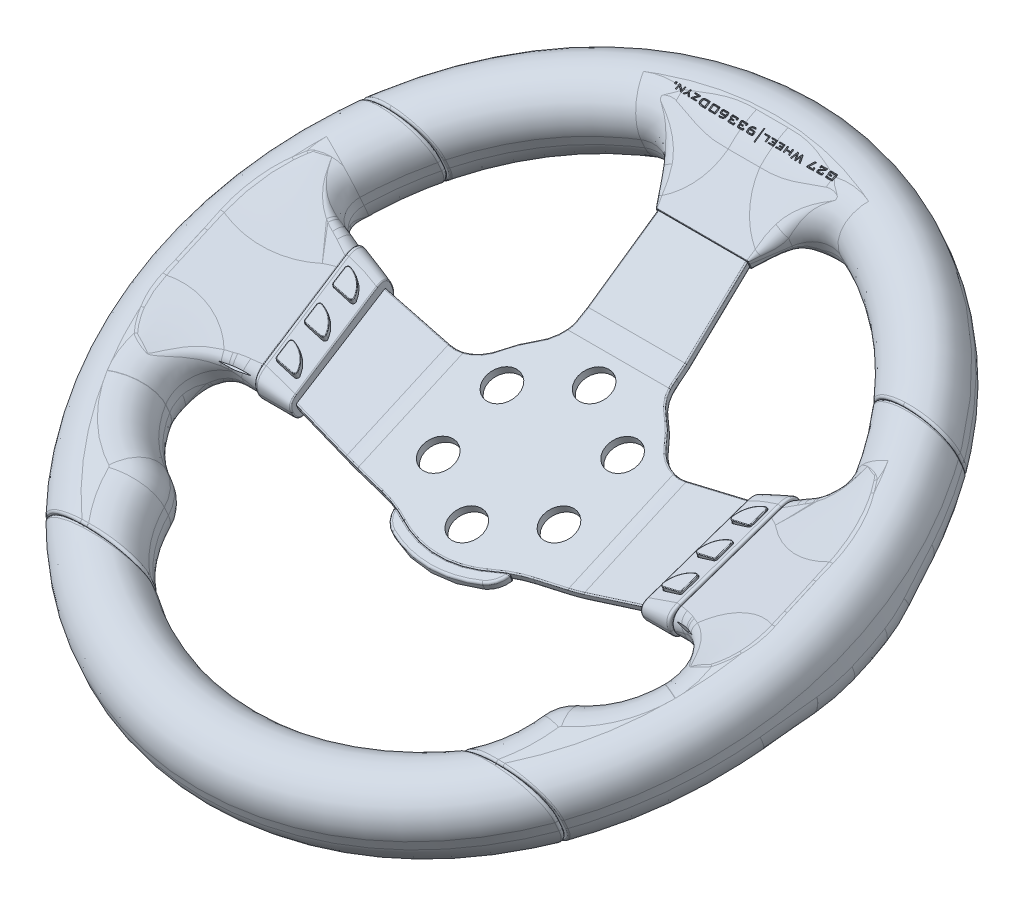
SolidWorks part; units mm, degrees
ref_plane "Plan de face" through (0, 0, 0) normal (0, 0, 1) x (1, 0, 0)
ref_plane "Plan de dessus" through (0, 0, 0) normal (0, 1, 0) x (1, 0, 0)
ref_plane "Plan de droite" through (0, 0, 0) normal (1, 0, 0) x (0, 0, -1)
imported_body "Importée1"
imported_body "Importée2"
imported_body "Importée3"
imported_body "Importée4"
imported_body "Importée5"
imported_body "Importée6"
imported_body "Importée9"
sketch "Esquisse1" plane through (0, 93.3688, 41.5705) normal (0, -0.9135, -0.4067) x (1, 0, 0)
  line L0 (-4.6276, 20.5681) -> (-20.3337, 20.5681) construction
  line L1 (20.3337, 20.5681) -> (4.6276, 20.5681) construction
  line L2 (-4.6276, 20.5681) -> (-20.3337, 20.5681)
  line L3 (20.3337, 20.5681) -> (4.6276, 20.5681)
  line L4 (-20.3337, 20.5681) -> (-52.2614, 45.9207)
  line L5 (-52.2614, 45.9207) -> (-52.2614, 53.789)
  line L6 (20.3337, 20.5681) -> (49.4464, 44.789)
  line L7 (52.2614, 63.789) -> (52.2614, 53.789)
  line L8 (25.9966, 95.5201) -> (49.5977, 76.0028)
  line L9 (-22.643, 97.6772) -> (-50.5638, 72.9154)
  line L10 (-52.2614, 63.789) -> (-52.2614, 53.789)
  arc A0 (18.125, 99.9774) -> (-17.9803, 100.0408) centre (0, 58.789) ccw construction
  arc A1 (25.9966, 95.5201) -> (-22.643, 97.6772) centre (0, 58.789) ccw
  arc A2 (50.8985, 45.9207) -> (52.2614, 53.789) centre (0, 58.789) ccw construction
  arc A3 (50.8985, 45.9207) -> (52.2614, 53.789) centre (0, 58.789) ccw
  arc A4 (52.2614, 63.789) -> (50.8985, 71.6573) centre (0, 58.789) ccw construction
  arc A5 (52.2614, 63.789) -> (49.5977, 76.0028) centre (0, 58.789) ccw
  arc A6 (-50.8985, 71.6573) -> (-52.2614, 63.789) centre (0, 58.789) ccw construction
  arc A7 (-50.5638, 72.9154) -> (-52.2614, 63.789) centre (0, 58.789) ccw
  spline S0 degree 3 poles (319.538, 1990.0536) (213.0253, 460.8347) (-0.0002, -420.2577) (-213.0257, 460.8365) (-319.5386, 1990.0629) knots -34.024973 -34.024973 -34.024973 -34.024973 0.5 35.025043 35.025043 35.025043 35.025043 only from (4.6276, 20.5681) to (-4.6276, 20.5681) construction
  spline S1 degree 3 poles (4.6276, 20.5681) (3.0851, 20.3813) (0, 20.1966) (-3.0851, 20.3813) (-4.6276, 20.5681) knots 0 0 0 0 0.5 1 1 1 1
  spline S2 degree 3 poles (-1746.5497, 922.2979) (-505.7748, 346.3624) (64.597, 66.778) (50.6097, 45.3294) (50.4983, 45.2081) (41.6848, 38.3318) (-35.6216, 132.8904) (1780.5986, 1042.0659) knots -37.938466 -37.938466 -37.938466 -37.938466 0.25 0.25 0.5 0.5 17.049565 17.049565 17.049565 17.049565 only from (50.8985, 45.9207) to (49.4464, 44.789) construction
  spline S3 degree 3 poles (50.8985, 45.9207) (50.8576, 45.759) (50.7917, 45.6084) (50.6097, 45.3294) (50.4983, 45.2081) (50.1048, 44.9011) (49.7798, 44.789) (49.4464, 44.789) knots 0 0 0 0 0.25 0.25 0.5 0.5 1 1 1 1
extrude "Extrusion1" cut sketch "Esquisse1" along normal blind 70
sketch "Esquisse2" plane through (0, 0, 0) normal (1, 0, 0) x (0, 0, -1)
  line L0 (-150.6975, 0) -> (-159.1345, 16.2248)
  line L1 (-159.1345, 16.2248) -> (-39.2531, 70.6779)
  line L2 (-39.2531, 70.6779) -> (-32.0668, 54.8567)
  line L3 (-32.0668, 54.8567) -> (-150.6975, 0)
extrude "Extrusion2" cut sketch "Esquisse2" against normal through all and the other way through all
sketch "Esquisse3" plane through (0, 96.1094, 42.7907) normal (0, 0.9135, 0.4067) x (1, 0, 0)
  line L5 (-42.2232, -42.3364) -> (-42.2232, -88.0317)
  line L6 (-42.2232, -88.0317) -> (-30.3803, -90.4412)
  line L7 (30.3803, -90.4412) -> (42.2232, -88.0317)
  line L8 (42.2232, -88.0317) -> (42.2232, -42.3364)
  line L9 (20.2102, -20.1699) -> (-20.2102, -20.1698)
  line L10 (-42.2232, -42.3364) -> (-42.2232, -88.0317)
  line L11 (-42.2232, -88.0317) -> (-30.3803, -90.4412)
  line L12 (30.3803, -90.4412) -> (42.2232, -88.0317)
  line L13 (42.2232, -88.0317) -> (42.2232, -42.3364)
  line L14 (20.2102, -20.1699) -> (-20.2102, -20.1698)
  arc A1 (20.2102, -20.1699) -> (25.2791, -27.7895) centre (35.0747, -15.7772) ccw
  arc A2 (20.2102, -20.1699) -> (25.2791, -27.7895) centre (35.0747, -15.7772) ccw
  spline S8 degree 2 poles (2349.6089, -1843.8638) (136.6279, 148.0238) (-29.3795, -31.644) (-195.3029, -211.221) (1958.9841, -2265.5925) knots -42.86377 -42.86377 -42.86377 0.5 0.5 43.850219 43.850219 43.850219 only from (-25.2791, -27.7895) to (-32.8983, -36.0359)
  spline S9 degree 2 poles (-2120.1303, 2113.1345) (73.887, 69.5745) (-34.7282, -38.2211) (-35.7616, -39.2466) (-36.9687, -40.0623) (-38.1751, -40.8775) (-39.5131, -41.454) (-179.9404, -101.9651) (-1268.1978, 2691.2035) knots -26.486354 -26.486354 -26.486354 0.25 0.25 0.5 0.5 0.75 0.75 27.475703 27.475703 27.475703 only from (-32.8983, -36.0359) to (-42.2232, -42.3364)
  spline S10 degree 2 poles (-1342.3397, -2772.7242) (-295.9252, -0.5752) (-23.7336, -92.229) (248.3282, -183.8392) (-587.7732, -3025.8093) knots -41.150282 -41.150282 -41.150282 0.5 0.5 42.137021 42.137021 42.137021 only from (-30.3803, -90.4412) to (-17.3593, -94.8258)
  spline S11 degree 2 poles (507.0216, 2848.8116) (-248.6135, -42.3339) (-9.0146, -97.76) (-6.8052, -98.2711) (-4.5512, -98.5292) (-2.2835, -98.789) (0, -98.789) (2.2825, -98.789) (4.5512, -98.5292) (6.8042, -98.2712) (9.0146, -97.76) (248.5539, -42.3542) (-503.9942, 2849.3538) knots -13.566852 -13.566852 -13.566852 0.25 0.25 0.375 0.375 0.5 0.5 0.625 0.625 0.75 0.75 14.564908 14.564908 14.564908 only from (-17.3593, -94.8258) to (17.3593, -94.8258)
  spline S12 degree 2 poles (595.0999, -3024.3472) (-248.4561, -183.8883) (23.7336, -92.229) (295.7936, -0.6135) (1349.0584, -2769.4567) knots -41.150282 -41.150282 -41.150282 0.5 0.5 42.137021 42.137021 42.137021 only from (17.3593, -94.8258) to (30.3803, -90.4412)
  spline S13 degree 2 poles (1257.3426, 2696.0867) (180.0517, -102.0017) (39.5131, -41.454) (38.176, -40.878) (36.9687, -40.0623) (35.7624, -39.2473) (34.7282, -38.2211) (-73.8115, 69.4849) (2111.5505, 2121.3847) knots -26.486363 -26.486363 -26.486363 0.25 0.25 0.5 0.5 0.75 0.75 27.475712 27.475712 27.475712 only from (42.2232, -42.3364) to (32.8983, -36.0359)
  spline S14 degree 2 poles (-1964.9833, -2260.1509) (195.3819, -211.3164) (29.3795, -31.644) (-136.5391, 147.9375) (-2354.5599, -1837.4537) knots -42.86377 -42.86377 -42.86377 0.5 0.5 43.850219 43.850219 43.850219 only from (32.8983, -36.0359) to (25.2791, -27.7895)
  spline S15 degree 2 poles (-2696.6735, 1325.8536) (43.5314, 116.1311) (-21.0269, -22.3277) (-21.5211, -23.3877) (-22.1694, -24.3623) (-22.8172, -25.336) (-23.6044, -26.2023) (-126.2476, -139.1434) (-2313.0147, 1906.571) knots -32.771815 -32.771815 -32.771815 0.25 0.25 0.5 0.5 0.75 0.75 33.753502 33.753502 33.753502 only from (-20.2102, -20.1698) to (-25.2791, -27.7895)
  spline S16 degree 2 poles (-25.2791, -27.7895) (-27.4653, -29.5724) (-29.3795, -31.644) (-31.2932, -33.7153) (-32.8983, -36.0359) knots 0 0 0 0.5 0.5 1 1 1
  spline S17 degree 2 poles (-32.8983, -36.0359) (-33.7126, -37.2131) (-34.7282, -38.2211) (-35.7616, -39.2466) (-36.9687, -40.0623) (-38.1751, -40.8775) (-39.5131, -41.454) (-40.8267, -42.02) (-42.2232, -42.3364) knots 0 0 0 0.25 0.25 0.5 0.5 0.75 0.75 1 1 1
  spline S18 degree 2 poles (-30.3803, -90.4412) (-27.0012, -91.1287) (-23.7336, -92.229) (-20.4665, -93.3291) (-17.3593, -94.8258) knots 0 0 0 0.5 0.5 1 1 1
  spline S19 degree 2 poles (-17.3593, -94.8258) (-13.3498, -96.7571) (-9.0146, -97.76) (-6.8052, -98.2711) (-4.5512, -98.5292) (-2.2835, -98.789) (0, -98.789) (2.2825, -98.789) (4.5512, -98.5292) (6.8042, -98.2712) (9.0146, -97.76) (13.3494, -96.7573) (17.3593, -94.8258) knots 0 0 0 0.25 0.25 0.375 0.375 0.5 0.5 0.625 0.625 0.75 0.75 1 1 1
  spline S20 degree 2 poles (17.3593, -94.8258) (20.466, -93.3294) (23.7336, -92.229) (27.0006, -91.1289) (30.3803, -90.4412) knots 0 0 0 0.5 0.5 1 1 1
  spline S21 degree 2 poles (42.2232, -42.3364) (40.8272, -42.0202) (39.5131, -41.454) (38.176, -40.878) (36.9687, -40.0623) (35.7624, -39.2473) (34.7282, -38.2211) (33.7129, -37.2136) (32.8983, -36.0359) knots 0 0 0 0.25 0.25 0.5 0.5 0.75 0.75 1 1 1
  spline S22 degree 2 poles (32.8983, -36.0359) (31.2935, -33.7157) (29.3795, -31.644) (27.4658, -29.5728) (25.2791, -27.7895) knots 0 0 0 0.5 0.5 1 1 1
  spline S23 degree 2 poles (-20.2102, -20.1698) (-20.5382, -21.2795) (-21.0269, -22.3277) (-21.5211, -23.3877) (-22.1694, -24.3623) (-22.8172, -25.336) (-23.6044, -26.2023) (-24.382, -27.0578) (-25.2791, -27.7895) knots 0 0 0 0.25 0.25 0.5 0.5 0.75 0.75 1 1 1
  dimension "D1" = 0
extrude "Extrusion3" cut sketch "Esquisse3" along normal blind 70
sketch "Esquisse4" plane through (0, 96.1094, 42.7907) normal (0, 0.9135, 0.4067) x (1, 0, 0)
  circle A0 centre (0, -86.789) radius 6.5
  circle A1 centre (-24.2487, -72.789) radius 6.5
  circle A2 centre (-24.2487, -44.789) radius 6.5
  circle A3 centre (0, -30.789) radius 6.5
  circle A4 centre (24.2487, -44.789) radius 6.5
  circle A5 centre (24.2487, -72.789) radius 6.5
  point P0 (0, -30.789)
  point P1 (0, -58.789)
  dimension "D1" = 13
  dimension "D2" = 28
  dimension "D3" = 28
extrude "Extrusion4" cut sketch "Esquisse4" against normal blind 70
ref_plane "Plan2" through (72.4598, 72.5562, 92.2781) normal (-0.9859, -0.1527, -0.068) x (-0.0672, -0.0104, 0.9977)
ref_plane "Plan3" through (68.0194, 10.532, 4.6892) normal (-0.9859, -0.1527, -0.068) x (-0.0672, -0.0104, 0.9977)
sketch "Esquisse6" plane through (68.0194, 10.532, 4.6892) normal (-0.9859, -0.1527, -0.068) x (-0.0672, -0.0104, 0.9977)
  line L0 (95.9722, 59.6864) -> (86.6503, 63.7771)
  line L1 (86.6503, 63.7771) -> (85.0152, 61.2486)
  line L2 (85.0152, 61.2486) -> (86.1174, 56.1108)
  line L3 (86.1174, 56.1108) -> (91.6218, 53.6953)
  line L4 (91.6218, 53.6953) -> (95.2149, 56.9046)
  line L5 (95.2149, 56.9046) -> (95.9722, 59.6864)
extrude "Extrusion5" cut sketch "Esquisse6" along normal blind 11
ref_plane "Plan4" through (-62.0021, 67.683, 98.8655) normal (0.9859, -0.1527, -0.068) x (-0.0672, 0.0104, -0.9977)
ref_plane "Plan5" through (-68.2099, 10.5615, 4.7023) normal (0.9859, -0.1527, -0.068) x (-0.0672, 0.0104, -0.9977)
sketch "Esquisse8" plane through (-68.2099, 10.5615, 4.7023) normal (0.9859, -0.1527, -0.068) x (-0.0672, 0.0104, -0.9977)
  line L0 (-86.7332, 63.7633) -> (-95.8899, 59.7438) construction
  line L1 (-86.7332, 63.7633) -> (-95.8899, 59.7438)
  line L2 (-86.7332, 63.7633) -> (-84.5802, 62.3525)
  line L3 (-84.5802, 62.3525) -> (-84.5802, 56.0942)
  line L4 (-84.5802, 56.0942) -> (-91.2173, 53.5828)
  line L5 (-91.2173, 53.5828) -> (-96.499, 56.0942)
  line L6 (-96.499, 56.0942) -> (-95.8899, 59.7438)
extrude "Extrusion7" cut sketch "Esquisse8" along normal blind 21
sketch "Esquisse9" plane through (0, 0, 0) normal (1, 0, 0) x (0, 0, -1)
  line L0 (-128.645, 134.9574) -> (-71.2474, 6.0402) construction
  line L1 (-229.0677, 20.836) -> (21.2438, 132.2818) construction
  line L2 (-229.8812, 22.6631) -> (-228.2542, 19.0089) construction
  line L3 (22.0572, 130.4547) -> (20.4303, 134.1089) construction
  circle A0 centre (-215.2202, 27.0013) radius 12
  circle A1 centre (9.512, 127.0585) radius 12
  dimension "D1" = 24
  dimension "D3" = 24
  dimension "D2" = 246
  dimension "D4" = 123
sketch "Esquisse11" plane through (0, 0, 0) normal (1, 0, 0) x (0, 0, -1)
  circle A1 centre (-215.2202, 27.0013) radius 12
  dimension "D1" = 24
revolve "Enlèvement de matière-Révolution4" cut sketch "Esquisse11" angle 360 about L0
ref_plane "Plan6" through (0, -25.4743, 57.2163) normal (0, 0.4067, -0.9135) x (-1, 0, 0)
sketch "Esquisse12" plane through (0, -25.4743, 57.2163) normal (0, 0.4067, -0.9135) x (-1, 0, 0)
  line L0 (-124.2035, 114.4224) -> (-124.2035, 106.1275) construction
  line L1 (0, 171.5817) -> (0, 37.0552) construction
  line L2 (-136.0731, 114.4224) -> (-133.4756, 103.634)
  line L3 (-118.6412, 124.908) -> (-88.3765, 114.4224)
  line L4 (-88.3765, 114.4224) -> (-88.3765, 107.6943)
  line L5 (-88.3765, 107.6943) -> (-103.1568, 110.8722)
  line L6 (124.2035, 114.4224) -> (124.2035, 106.1275) construction
  line L7 (88.3765, 107.6943) -> (103.1568, 110.8722)
  line L8 (88.3765, 114.4224) -> (88.3765, 107.6943)
  line L9 (118.6412, 124.908) -> (88.3765, 114.4224)
  line L10 (136.0731, 114.4224) -> (133.4756, 103.634)
  arc A0 (-118.6412, 124.908) -> (-136.0731, 114.4224) centre (-124.2035, 114.4224) ccw
  arc A1 (-133.4756, 103.634) -> (-114.9237, 103.6627) centre (-124.2035, 106.1275) ccw
  arc A2 (-103.1568, 110.8722) -> (-114.9237, 103.6627) centre (-105.2588, 101.0956) ccw
  arc A3 (103.1568, 110.8722) -> (114.9237, 103.6627) centre (105.2588, 101.0956) cw
  arc A4 (133.4756, 103.634) -> (114.9237, 103.6627) centre (124.2035, 106.1275) cw
  arc A5 (118.6412, 124.908) -> (136.0731, 114.4224) centre (124.2035, 114.4224) cw
  point P2 (-124.2035, 110.2749)
  point P24 (124.2035, 110.2749)
  dimension "D1" = 10
revolve "Enlèvement de matière-Révolution5" cut sketch "Esquisse12" angle 14 about L0
